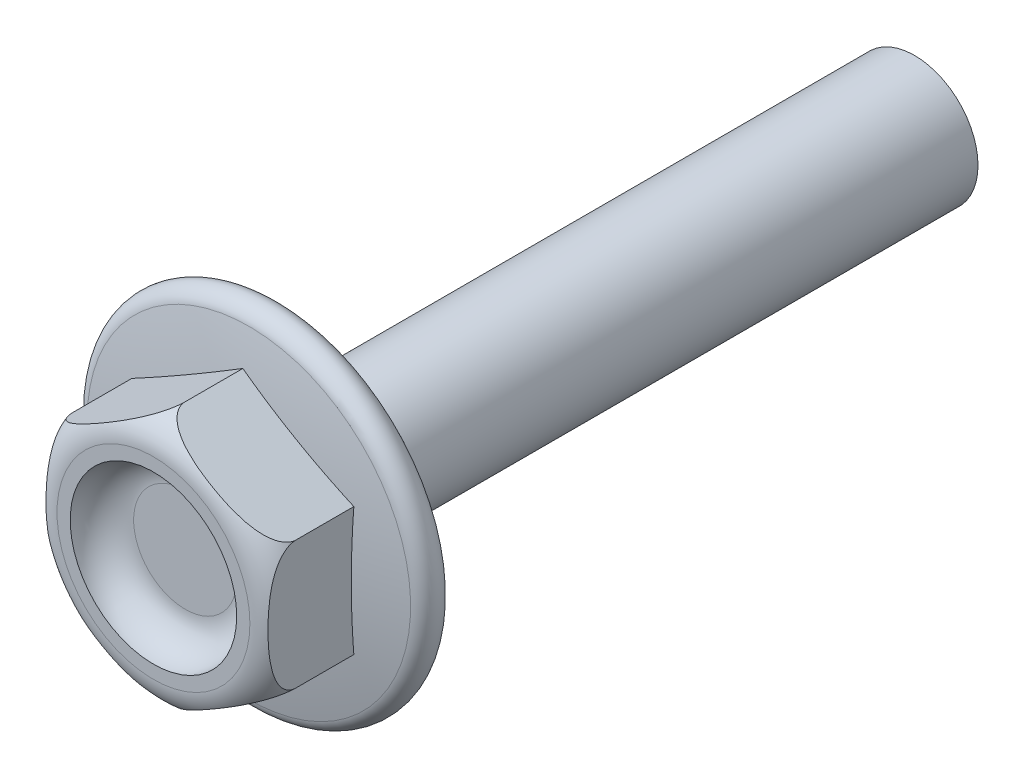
SolidWorks part; units mm, degrees
ref_plane "Plane1" through (0, 0, 0) normal (0, 0, 1) x (1, 0, 0)
ref_plane "Plane2" through (0, 0, 0) normal (0, 1, 0) x (-1, 0, 0)
ref_plane "Plane3" through (0, 0, 0) normal (1, 0, 0) x (0, 0, -1)
extrude "Shank" add sketch "Shank Sketch" against normal blind 20
sketch "Shank Sketch" plane through (0, 0, 0) normal (0, 0, 1) x (1, 0, 0)
  line L0 (50, 0) -> (-50, 0) construction
  line L1 (0, -50) -> (0, 50) construction
  circle A0 centre (0, 0) radius 2
  dimension "Shank diameter" = 4
extrude "Head" add sketch "Head Sketch" along normal blind 4
sketch "Head Sketch" plane through (0, 0, 0) normal (0, 0, 1) x (1, 0, 0)
  line L0 (0, 4.0415) -> (3.5, 2.0207)
  line L1 (3.5, 2.0207) -> (3.5, -2.0207)
  line L2 (3.5, -2.0207) -> (0, -4.0415)
  line L3 (0, -4.0415) -> (-3.5, -2.0207)
  line L4 (-3.5, -2.0207) -> (-3.5, 2.0207)
  line L5 (-3.5, 2.0207) -> (0, 4.0415)
  line L6 (3.5, 2.0207) -> (-3.5, -2.0207) construction
  line L7 (0, 4.0415) -> (0, -4.0415) construction
  line L8 (-3.5, 2.0207) -> (3.5, -2.0207) construction
  point P0 (0, 0)
  dimension "D1" = 60
  dimension "D2" = 60
  dimension "Width across flats" = 7
sketch "Sketch3" plane through (0, 0, 0) normal (0, 1, 0) x (-1, 0, 0)
  line L0 (0, 0) -> (0, 3) construction
  line L1 (0, -20) -> (0, 0) construction
  line L4 (-5, 0) -> (0, 0)
  line L5 (0, 0) -> (0, 1.5)
  arc A0 (0, 1.5) -> (-5.099, 0.9901) centre (0, -24.25) ccw
  arc A1 (-5, 0) -> (-5.099, 0.9901) centre (-5, 0.5) cw
  dimension "D1" = 0.5
  dimension "D2" = 10
  dimension "D3" = 1.5
revolve "Flange" add sketch "Sketch3" angle 360 about L0
sketch "Sketch5" plane through (0, 0, 0) normal (1, 0, 0) x (0, 0, -1)
  line L0 (-4, -3.0415) -> (-4, -4.0415)
  line L1 (-4, -4.0415) -> (-3, -4.0415)
  line L2 (-4, -4.0415) -> (-1.1809, -4.0415) construction
  line L3 (-4, -4.0415) -> (-4, -2.0207) construction
  line L5 (-15.0856, 0) -> (-8.1394, 0) construction
  line L6 (50, 0) -> (-50, 0) construction
  arc A0 (-4, -3.0415) -> (-3, -4.0415) centre (-3, -3.0415) ccw
  dimension "D1" = 1
revolve "Head Trim" cut sketch "Sketch5" angle 360 about L5
sketch "Sketch6" plane through (0, 0, 4) normal (0, 0, 1) x (1, 0, 0)
  circle A3 centre (0, 0) radius 2.625
  dimension "D1" = 5.25
extrude "Head Cut" cut sketch "Sketch6" against normal blind 1
fillet "Fillet1" radius 1 1 edges at (2.625, 0, 3)
equation "\"D1@Sketch6\" = \"Width across flats@Head Sketch\"*3/4"
